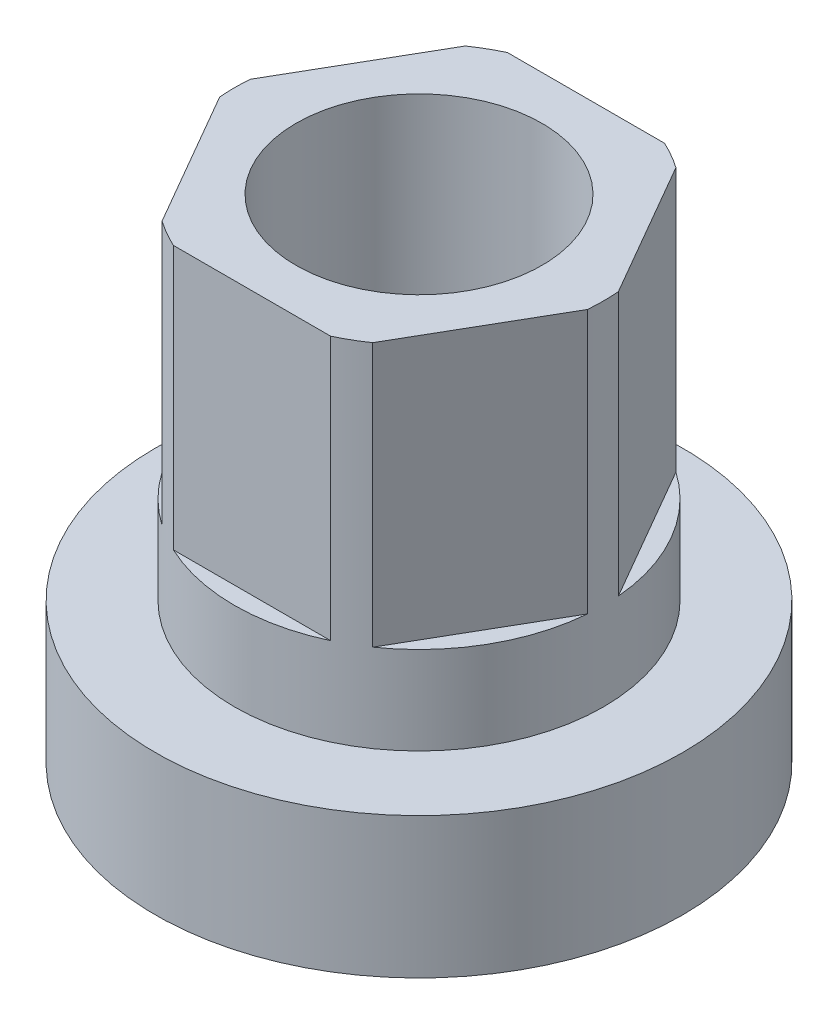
SolidWorks part; units mm, degrees
ref_plane "Plan1" through (0, 0, 0) normal (0, 0, 1) x (1, 0, 0)
ref_plane "Plan2" through (0, 0, 0) normal (0, 1, 0) x (1, 0, 0)
ref_plane "Plan3" through (0, 0, 0) normal (1, 0, 0) x (0, 0, -1)
sketch "Esquisse1" plane through (0, 0, 0) normal (0, 0, 1) x (1, 0, 0)
  line L0 (0, 66.1332) -> (0, -48.0926) construction
  line L1 (50, 0) -> (-50, 0) construction
  line L2 (7, 28) -> (15, 28)
  line L3 (7, 28) -> (7, 0)
  line L4 (7, 0) -> (15, 0)
  line L5 (15, 28) -> (15, 0)
  line L6 (0, -50) -> (0, 50) construction
  dimension "D1" = 14
  dimension "D2" = 30
  dimension "D3" = 28
revolve "Révolution1" add sketch "Esquisse1" angle 360 about L0
sketch "Esquisse4" plane through (0, 0, 0) normal (0, 0, 1) x (1, 0, 0)
  line L0 (0, 43.6485) -> (0, -15.4203) construction
  line L1 (0, -15.4) -> (0, 15.4) construction
  line L2 (15, 28) -> (-15, 28) construction
  line L3 (-10.5, 28) -> (-15, 28)
  line L4 (-10.5, 28) -> (-10.5, 8)
  line L5 (-10.5, 8) -> (-15, 8)
  line L6 (-15, 28) -> (-15, 8)
  line L7 (-15, 28) -> (-15, 0) construction
  line L8 (-15, 0) -> (15, 0) construction
  dimension "D1" = 21
  dimension "D2" = 8
revolve "Enlèvement de matière-Révolution1" cut sketch "Esquisse4" angle 360 about L0
sketch "Esquisse3" plane through (0, 28, 0) normal (0, 1, 0) x (1, 0, 0)
  line L1 (5.4848, -9.5) -> (10.9697, 0)
  line L2 (10.9697, 0) -> (5.4848, 9.5)
  line L3 (5.4848, 9.5) -> (-5.4848, 9.5)
  line L4 (-5.4848, 9.5) -> (-10.9697, 0)
  line L5 (-10.9697, 0) -> (-5.4848, -9.5)
  line L6 (-5.4848, -9.5) -> (5.4848, -9.5)
  circle A0 centre (0, 0) radius 9.5 construction
  dimension "D1" = 19
extrude "Enlèv. mat.-Extru.1" cut sketch "Esquisse3" against normal blind 15 flip side to cut
